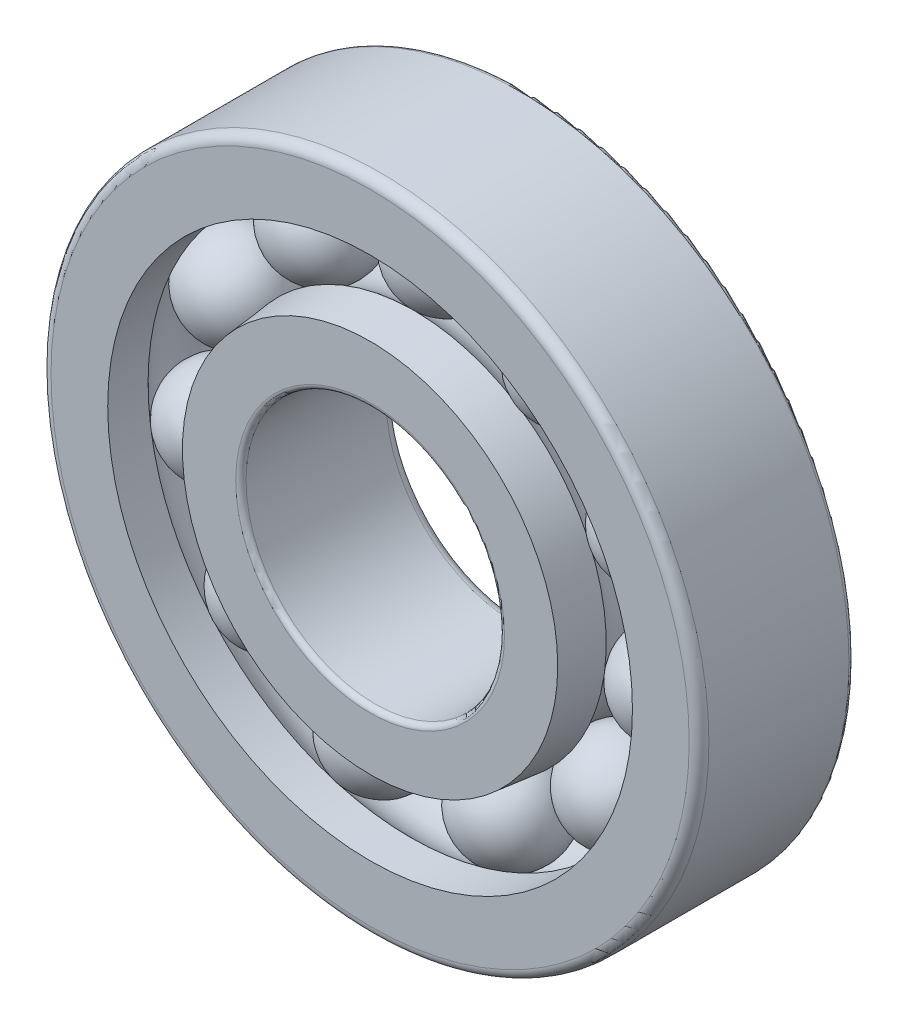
SolidWorks part; units mm, degrees
ref_plane "Front Plane" through (0, 0, 0) normal (0, 0, 1) x (1, 0, 0)
ref_plane "Top Plane" through (0, 0, 0) normal (0, 1, 0) x (1, 0, 0)
ref_plane "Right Plane" through (0, 0, 0) normal (1, 0, 0) x (0, 0, -1)
other "Configuration Table"
sketch "BaseSke" plane through (0, 0, 0) normal (1, 0, 0) x (0, 0, -1)
  line L0 (-47.2296, 0) -> (24.6132, 0) construction
  line L1 (-47.2296, 48.75) -> (24.6132, 48.75) construction
  line L2 (0, 129.5214) -> (0, -86.3012) construction
  line L3 (0, 59.375) -> (0, 38.125)
  line L4 (-16.5, 70) -> (16.5, 70) construction
  line L5 (-16.5, 27.5) -> (16.5, 27.5) construction
  arc A0 (0, 59.375) -> (0, 38.125) centre (0, 48.75) ccw
revolve "Ball" add sketch "BaseSke" angle 360 about L3
sketch "OuterRaceSke" plane through (0, 0, 0) normal (1, 0, 0) x (0, 0, -1)
  line L0 (0, 0) -> (0, 87.5396) construction
  line L1 (-16.5, 70) -> (16.5, 70)
  line L2 (-16.5, 70) -> (-16.5, 55.8333)
  line L3 (-16.5, 55.8333) -> (-7.906, 55.8333)
  line L4 (16.5, 70) -> (16.5, 57.5676)
  line L5 (-50.3916, 0) -> (55.2197, 0) construction
  line L6 (-47.2296, 48.75) -> (24.6132, 48.75) construction
  line L8 (16.5, 57.5676) -> (7.1607, 56.586)
  line L9 (0, 55.8333) -> (-0.8658, 59.0647) construction
  line L10 (0, 55.8333) -> (7.1607, 56.586) construction
  arc A0 (7.1607, 56.586) -> (-7.906, 55.8333) centre (0, 48.75) ccw
revolve "OuterRace" add sketch "OuterRaceSke" angle 360 about L5
sketch "InnerRaceSke" plane through (0, 0, 0) normal (1, 0, 0) x (0, 0, -1)
  line L0 (-70.8626, 0) -> (113.5527, 0) construction
  line L1 (0, 58.441) -> (0, -70.8113) construction
  line L2 (-16.5, 27.5) -> (16.5, 27.5)
  line L3 (-16.5, 27.5) -> (-16.5, 41.6667)
  line L4 (-16.5, 41.6667) -> (-7.906, 41.6667)
  line L5 (16.5, 27.5) -> (16.5, 41.6667)
  line L6 (0, 129.5214) -> (0, -86.3012) construction
  line L7 (7.906, 41.6667) -> (16.5, 41.6667)
  arc A0 (-7.906, 41.6667) -> (7.906, 41.6667) centre (0, 48.75) ccw
  arc A1 (0, 59.375) -> (0, 38.125) centre (0, 48.75) ccw construction
revolve "InnerRace" add sketch "InnerRaceSke" angle 360 about L0
fillet "Fillet1" radius 2.1 2 edges at (27.5, 0, -16.5) (70, 0, 16.5)
fillet "Fillet2" radius 1.1 2 edges at (70, 0, -16.5) (27.5, 0, 16.5)
sketch "CutInnerRaceSke" plane through (0, 0, 0) normal (1, 0, 0) x (0, 0, -1)
  line L0 (-7.906, 41.6667) -> (-16.5, 41.6667)
  line L1 (-16.5, 41.6667) -> (-16.5, 39.9324)
  line L2 (-16.5, 39.9324) -> (-7.1607, 40.914)
  line L3 (-7.1607, 40.914) -> (0, 41.6667) construction
  line L4 (0, 58.441) -> (0, -70.8113) construction
  line L5 (-28.3066, 0) -> (35.2466, 0) construction
  arc A0 (-7.906, 41.6667) -> (-7.1607, 40.914) centre (0, 48.75) ccw
  arc A1 (-7.906, 41.6667) -> (7.906, 41.6667) centre (0, 48.75) ccw construction
revolve "CutInnerRace" cut sketch "CutInnerRaceSke" angle 360 about L5
pattern_circular "CirPatternBall" count 11 over 360 about axis through (0, 0, 0) along (0, 0, 1) of "Ball"
sketch "SimplifiedSke" plane through (0, 0, 0) normal (1, 0, 0) x (0, 0, -1)
  line L0 (37.5911, 0) -> (-37.5911, 0) construction
  circle A0 centre (0, 48.75) radius 10.625
  arc A1 (0, 59.375) -> (0, 38.125) centre (0, 48.75) ccw construction
revolve "Simplified" [suppressed] add sketch "SimplifiedSke" angle 360 about L0
equation "\"D1@BaseSke\" =  (\"Bearing_Outside_Diameter@BaseSke\"  +  \"Bearing_Inside_Diameter@BaseSke\"  )  / 4"
equation "\"Ball_diameter@BaseSke\" =  ( \"Bearing_Outside_Diameter@BaseSke\" - \"Bearing_Inside_Diameter@BaseSke\" ) / 4 "
equation "\"D2@OuterRaceSke\" = \"Bearing_Outside_Diameter@BaseSke\" -  ( \"Bearing_Outside_Diameter@BaseSke\" - \"Bearing_Inside_Diameter@BaseSke\" )  / 3"
equation "\"D4@OuterRaceSke\" = (  \"Bearing_Outside_Diameter@BaseSke\" - \"Bearing_Inside_Diameter@BaseSke\" ) / 4 -0.02"
equation "\"D3@OuterRaceSke\" = \"Angle@OuterRaceSke\"/2.5"
equation "\"D1@InnerRaceSke\" = \"Bearing_Inside_Diameter@BaseSke\" +  ( \"Bearing_Outside_Diameter@BaseSke\" - \"Bearing_Inside_Diameter@BaseSke\" )  / 3"
equation "\"D2@InnerRaceSke\" = \"D4@OuterRaceSke\""
equation "\"D1@CirPatternBall\" = int( \"D1@BaseSke\"* pi  * 2 / \"Ball_diameter@BaseSke\"/1.2 ) -1"
equation "\"D1@CutInnerRaceSke\" = \"D3@OuterRaceSke\""
